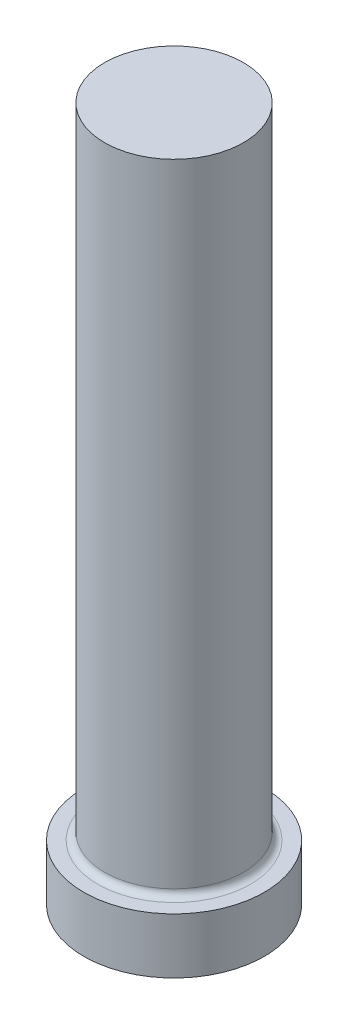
SolidWorks part; units mm, degrees
ref_plane "Plano frontal" through (0, 0, 0) normal (0, 0, 1) x (1, 0, 0)
ref_plane "Plano superior" through (0, 0, 0) normal (0, 1, 0) x (1, 0, 0)
ref_plane "Plano direito" through (0, 0, 0) normal (1, 0, 0) x (0, 0, -1)
sketch "Esboço1" plane through (0, 0, 0) normal (0, 0, 1) x (1, 0, 0)
  line L0 (0, 0) -> (13, 0)
  line L1 (13, 0) -> (13, 8)
  line L2 (13, 8) -> (11, 8)
  line L3 (10, 9) -> (10, 100)
  line L4 (10, 100) -> (0, 100)
  line L5 (0, 100) -> (0, 0) construction
  line L6 (0, 0) -> (0, 100)
  arc A0 (11, 8) -> (10, 9) centre (11, 9) cw
  dimension "D3" = 1
  dimension "D1" = 26
  dimension "D2" = 20
  dimension "D4" = 8
  dimension "D5" = 100
revolve "Revolução1" add sketch "Esboço1" angle 360 about L5
sketch "Esboço2"
  dimension "D1" = 0.975
  dimension "D2" = 2.275
  dimension "D3" = 1.4625
  dimension "D4" = 6.9875
wrap "Envolver1" sketch "Esboço2" wrap type deboss source sketch "Esboço2" thickness 0.1 parameters "D1"=0.1
